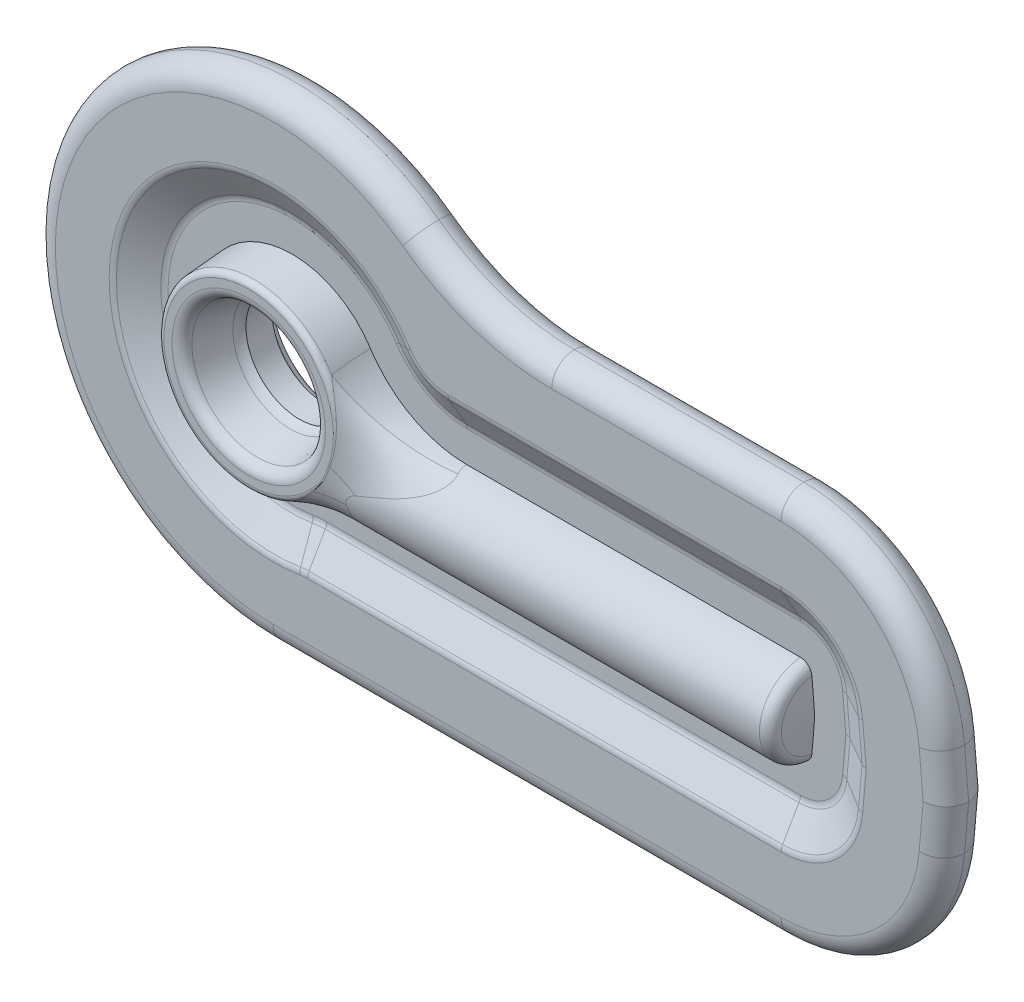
SolidWorks part; units mm, degrees
ref_plane "Plan1" through (0, 0, 0) normal (0, 0, 1) x (1, 0, 0)
ref_plane "Plan2" through (0, 0, 0) normal (0, 1, 0) x (1, 0, 0)
ref_plane "Plan3" through (0, 0, 0) normal (1, 0, 0) x (0, 0, -1)
sketch "Esquisse1" plane through (0, 0, 0) normal (0, 0, 1) x (1, 0, 0)
  circle A0 centre (0, 0) radius 16.2
  dimension "D1" = 32.4
extrude "Base-Extrusion" add sketch "Esquisse1" along normal mid plane 16.3 draft 4
sketch "Esquisse2" plane through (0, 0, 0) normal (0, 0, 1) x (1, 0, 0)
  line L0 (-20, 0) -> (20, 0) construction
  line L1 (-20, -8) -> (94.3291, -8) construction
  line L2 (0, -15.7) -> (88.1673, -15.7)
  line L3 (90.1597, -13.8743) -> (90.6737, -8)
  line L4 (0, -15.7) -> (0, -8)
  line L5 (0, -8) -> (90.6737, -8)
  circle A0 centre (0, 0) radius 15.6301 construction
  arc A1 (90.1597, -13.8743) -> (88.1673, -15.7) centre (88.1673, -13.7) cw
  point P13 (90, -15.7)
  dimension "D5" = 2
  dimension "D1" = 8
  dimension "D2" = 7.7
  dimension "D3" = 95
  dimension "D4" = 90
revolve "Boss.-Révol.1" add sketch "Esquisse2" angle 360 about L1
fillet "Congé4" radius 1
fillet "Congé5" radius 20
sketch "Esquisse3" plane through (0, 0, 0) normal (0, 1, 0) x (1, 0, 0)
  line L0 (0, 20.6238) -> (0, -15.1969) construction
  line L1 (0, 0) -> (0, -7.2198) construction
  line L2 (11.7426, -8.15) -> (0, -8.15)
  line L3 (0, 2.85) -> (0, -8.15)
  line L4 (-14.6976, -8.15) -> (14.6976, -8.15) construction
  line L5 (9, 2.85) -> (11.7426, -8.15)
  line L7 (-32.9547, 0) -> (48.0586, 0) construction
  line L8 (-20, 0) -> (94.3291, 0) construction
  line L9 (0, 2.85) -> (9, 2.85)
  dimension "D2" = 9
  dimension "D1" = 14
  dimension "D4" = 11
revolve "Enlèvement de matière-Révolution1" cut sketch "Esquisse3" angle 360 about L0
fillet "Congé13" radius 5
fillet "Congé15" radius 2
sketch "Esquisse5" plane through (0, 0, 0) normal (0, 1, 0) x (1, 0, 0)
  line L0 (0, 16.1009) -> (0, -12.7842) construction
  line L1 (0, 0) -> (0, -7.2198) construction
  line L2 (0, 5.15) -> (10.8, 5.15)
  line L4 (0, 8.15) -> (0, 5.15)
  line L5 (10.8, 5.15) -> (11.548, 8.15)
  line L6 (11.548, 8.15) -> (0, 8.15)
  line L7 (14.6976, 8.15) -> (-14.6976, 8.15) construction
  dimension "D3" = 14
  dimension "D2" = 10.8
  dimension "D1" = 3
revolve "Enlèvement de matière-Révolution2" cut sketch "Esquisse5" angle 360 about L0
fillet "Congé16" radius 2
fillet "Congé17" radius 2
scale "Echelle1"
sketch "Esquisse7" plane through (0, 0, 0) normal (0, 0, 1) x (1, 0, 0)
  line L0 (97.4644, -1.6368) -> (98.0316, -8.12)
  line L1 (97.4644, -14.6032) -> (98.0316, -8.12)
  line L24 (6.0879, -21.9105) -> (89.4898, -21.9105)
  line L25 (89.4898, 5.6705) -> (30.8393, 5.6705)
  arc A0 (3.7119, -22.1086) -> (6.0879, -21.9105) centre (6.0879, -36.2605) cw
  arc A1 (18.8032, 12.2068) -> (30.8393, 5.6705) centre (30.8393, 20.0205) ccw
  circle A2 centre (0, 0) radius 14
  arc A15 (89.4898, -21.9105) -> (97.4644, -14.6032) centre (89.4898, -13.9055) ccw
  arc A16 (18.8032, 12.2068) -> (3.7119, -22.1086) centre (0, 0) ccw
  arc A17 (97.4644, -1.6368) -> (89.4898, 5.6705) centre (89.4898, -2.3345) ccw
  dimension "D2" = 14.35
  dimension "D3" = 14.35
  dimension "D1" = 28
  dimension "D4" = 170
extrude "Boss.-Extru.1" add sketch "Esquisse7" along normal mid plane 1.2
sketch "Esquisse8" plane through (0, 0, 0) normal (0, 0, 1) x (1, 0, 0)
  line L0 (0, 0) -> (0, -82.1677) construction
  line L1 (0, -42.3205) -> (89.4898, -42.3205)
  line L16 (117.7967, -16.382) -> (118.5196, -8.12)
  line L17 (118.5196, -8.12) -> (117.7967, 0.142)
  line L18 (89.4898, 26.0805) -> (49.0921, 26.0805)
  line L20 (97.4644, -14.6032) -> (98.0316, -8.12)
  line L21 (98.0316, -8.12) -> (97.4644, -1.6368)
  line L22 (89.4898, 5.6705) -> (30.8393, 5.6705)
  line L23 (6.0879, -21.9105) -> (89.4898, -21.9105)
  line L24 (97.4644, -14.6032) -> (98.0316, -8.12)
  line L25 (98.0316, -8.12) -> (97.4644, -1.6368)
  line L26 (89.4898, 5.6705) -> (30.8393, 5.6705)
  line L27 (6.0879, -21.9105) -> (89.4898, -21.9105)
  arc A0 (25.238, 33.9716) -> (0, -42.3205) centre (0, 0) ccw
  arc A1 (49.0921, 26.0805) -> (25.238, 33.9716) centre (49.0921, 66.0805) cw
  arc A18 (89.4898, -42.3205) -> (117.7967, -16.382) centre (89.4898, -13.9055) ccw
  arc A19 (117.7967, 0.142) -> (89.4898, 26.0805) centre (89.4898, -2.3345) ccw
  arc A21 (89.4898, -21.9105) -> (97.4644, -14.6032) centre (89.4898, -13.9055) ccw
  arc A22 (97.4644, -1.6368) -> (89.4898, 5.6705) centre (89.4898, -2.3345) ccw
  arc A23 (18.8032, 12.2068) -> (30.8393, 5.6705) centre (30.8393, 20.0205) ccw
  arc A24 (18.8032, 12.2068) -> (3.7119, -22.1086) centre (0, 0) ccw
  arc A25 (6.0879, -21.9105) -> (3.7119, -22.1086) centre (6.0879, -36.2605) ccw
  arc A26 (89.4898, -21.9105) -> (97.4644, -14.6032) centre (89.4898, -13.9055) ccw
  arc A27 (97.4644, -1.6368) -> (89.4898, 5.6705) centre (89.4898, -2.3345) ccw
  arc A28 (18.8032, 12.2068) -> (30.8393, 5.6705) centre (30.8393, 20.0205) ccw
  arc A29 (18.8032, 12.2068) -> (3.7119, -22.1086) centre (0, 0) ccw
  arc A30 (6.0879, -21.9105) -> (3.7119, -22.1086) centre (6.0879, -36.2605) ccw
  dimension "D2" = 0
  dimension "D1" = 28.415
  dimension "D3" = 28.415
  dimension "D4" = 40
extrude "Boss.-Extru.2" add sketch "Esquisse8" along normal mid plane 8
fillet "Congé9" radius 4
fillet "Congé10" radius 4
draft "Dépouille1" type of draft neutral plane draft angle 60 faces to draft 9 parameters "D1"=60
draft "Dépouille3" type of draft neutral plane draft angle 60 faces to draft 9 parameters "D1"=60
fillet "Congé11" radius 2
fillet "Congé12" radius 2
sketch "Esquisse9" plane through (0, 0, 0) normal (0, 0, 1) x (1, 0, 0)
  circle A1 centre (0, 0) radius 9.39
  dimension "D1" = 18.78
extrude "Enlèv. mat.-Extru.2" cut sketch "Esquisse9" against normal mid plane 30
